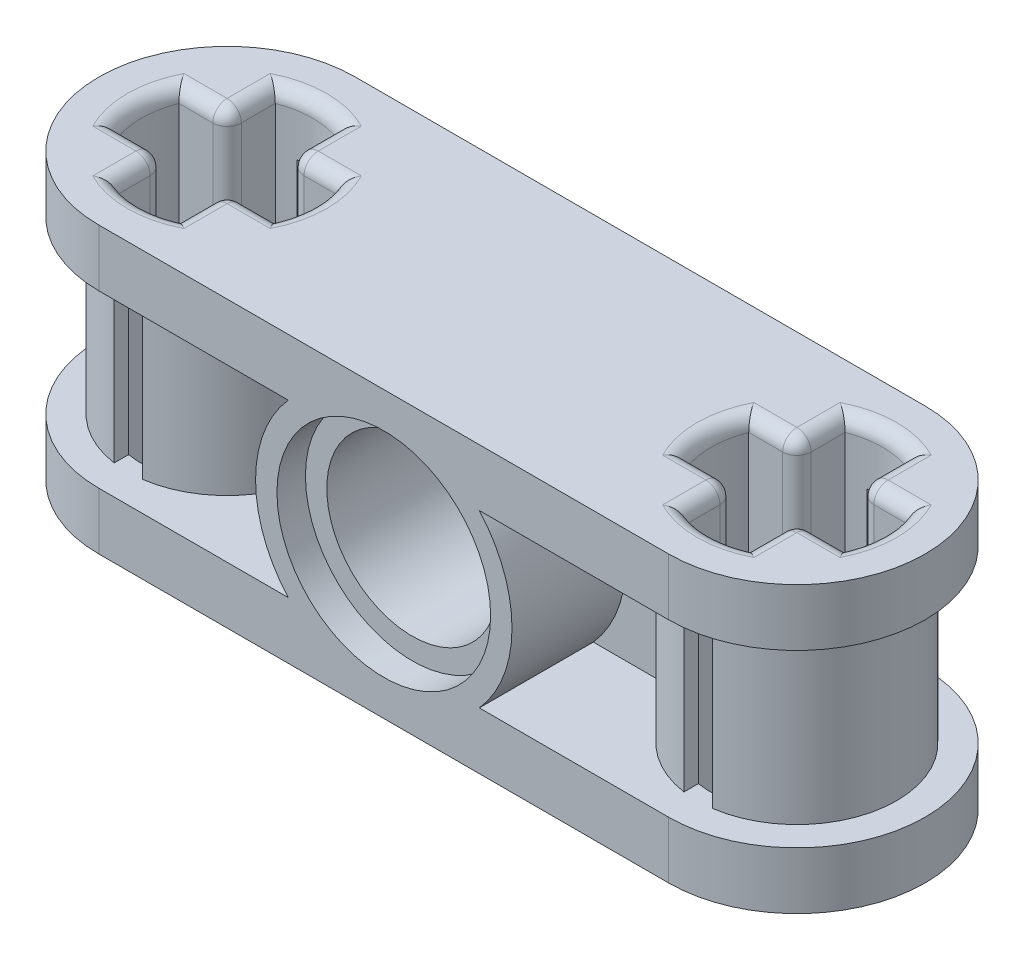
SolidWorks part; units mm, degrees
other "<3>-<Cut-Extrude3>"
other "<3>-<Cut-Extrude3>"
ref_plane "Front Plane" through (0, 0, 0) normal (0, 0, 1) x (1, 0, 0)
ref_plane "Top Plane" through (0, 0, 0) normal (0, 1, 0) x (1, 0, 0)
ref_plane "Right Plane" through (0, 0, 0) normal (1, 0, 0) x (0, 0, -1)
inserted part "3"
move or copy body "Body-Move/Copy2"
inserted part "34"
move or copy body "Body-Move/Copy8" placed by mates yes
other "Distance2" parameters "D1"=16
sketch "Sketch1" plane through (0, 11.0018, 0) normal (0, 1, 0) x (1, 0, 0)
  line L0 (-36.4578, -10.8814) -> (-20.4578, -10.8814)
  line L1 (-36.4578, -18.0814) -> (-20.4578, -18.0814)
  line L2 (-35.5338, -11.002) -> (-35.5338, -11.8382)
  line L3 (-35.5338, -17.1245) -> (-35.5338, -17.9608)
  line L5 (-21.3818, -17.1245) -> (-21.3818, -17.9608)
  line L6 (-21.3818, -11.002) -> (-21.3818, -11.8382)
  circle A0 centre (-36.4578, -14.4814) radius 3.6 construction
  arc A2 (-36.4578, -10.8814) -> (-35.5338, -11.002) centre (-36.4578, -14.4814) cw
  arc A4 (-35.5338, -11.8382) -> (-35.5338, -17.1245) centre (-36.4578, -14.4814) cw
  arc A6 (-35.5338, -17.9608) -> (-36.4578, -18.0814) centre (-36.4578, -14.4814) cw
  arc A7 (-21.3818, -17.9608) -> (-20.4578, -18.0814) centre (-20.4578, -14.4814) ccw
  arc A8 (-21.3818, -11.8382) -> (-21.3818, -17.1245) centre (-20.4578, -14.4814) ccw
  arc A9 (-20.4578, -10.8814) -> (-21.3818, -11.002) centre (-20.4578, -14.4814) ccw
extrude "Boss-Extrude1" add sketch "Sketch1" against normal up to surface (8 mm away)
ref_plane "Plane1" through (0, 7.0018, 0) normal (0, 1, 0) x (1, 0, 0)
sketch "Sketch3" plane through (0, 0, 18.0814) normal (0, 0, 1) x (1, 0, 0)
  line L0 (3.96, 7.0018) -> (-3.96, 7.0018) construction
  line L1 (-36.4578, 4.6018) -> (-36.4578, 9.4018) construction
  circle A0 centre (-28.4578, 7.0018) radius 2.4
  dimension "D1" = 8
extrude "Cut-Extrude3" cut sketch "Sketch3" against normal through all
sketch "Sketch4" plane through (0, 0, 18.0814) normal (0, 0, 1) x (1, 0, 0)
  line L0 (-33.3578, 9.4018) -> (-31.1411, 9.4018)
  line L1 (-23.5578, 9.4018) -> (-25.7745, 9.4018)
  line L2 (-23.5578, 4.6018) -> (-25.7745, 4.6018)
  line L4 (-33.3578, 4.6018) -> (-31.1411, 4.6018)
  line L5 (-33.3578, 9.4018) -> (-33.3578, 4.6018)
  line L7 (-23.5578, 9.4018) -> (-23.5578, 4.6018)
  arc A2 (-25.7745, 4.6018) -> (-25.7745, 9.4018) centre (-28.4578, 7.0018) ccw
  arc A3 (-31.1411, 9.4018) -> (-31.1411, 4.6018) centre (-28.4578, 7.0018) ccw
extrude "Cut-Extrude4" cut sketch "Sketch4" against normal blind 3.2
ref_plane "Plane2" through (0, 0, 14.4814) normal (0, 0, -1) x (-1, 0, 0)
mirror "Mirror1" about plane through (0, 0, 14.4814) normal (0, 0, -1) of "Cut-Extrude4"
sketch "Sketch5" plane through (0, 7.0018, 0) normal (0, 1, 0) x (1, 0, 0)
  line L0 (-36.4578, -11.6814) -> (-36.4578, -10.8814)
  line L1 (-36.4578, -10.8814) -> (-32.4578, -10.8814)
  line L2 (-20.4578, -10.8814) -> (-36.4578, -10.8814) construction
  line L3 (-32.4578, -10.8814) -> (-32.4578, -14.0814)
  line L4 (-32.4578, -14.0814) -> (-33.6865, -14.0814)
  line L5 (-36.4578, -18.0814) -> (-36.4578, -17.2814)
  line L7 (-36.4578, -18.0814) -> (-32.4578, -18.0814)
  line L8 (-36.4578, -18.0814) -> (-20.4578, -18.0814) construction
  line L9 (-32.4578, -18.0814) -> (-32.4578, -14.8814)
  line L10 (-32.4578, -14.8814) -> (-33.6865, -14.8814)
  line L11 (-28.4578, -10.8814) -> (-28.4578, -18.0814) construction
  line L12 (-24.4578, -14.8814) -> (-23.2291, -14.8814)
  line L13 (-24.4578, -18.0814) -> (-24.4578, -14.8814)
  line L14 (-20.4578, -18.0814) -> (-24.4578, -18.0814)
  line L15 (-20.4578, -18.0814) -> (-20.4578, -17.2814)
  line L16 (-24.4578, -14.0814) -> (-23.2291, -14.0814)
  line L17 (-24.4578, -10.8814) -> (-24.4578, -14.0814)
  line L18 (-20.4578, -10.8814) -> (-24.4578, -10.8814)
  line L19 (-20.4578, -11.6814) -> (-20.4578, -10.8814)
  arc A0 (-36.4578, -17.2814) -> (-33.6865, -14.8814) centre (-36.4578, -14.4814) ccw
  arc A1 (-33.6865, -14.0814) -> (-36.4578, -11.6814) centre (-36.4578, -14.4814) ccw
  arc A2 (-23.2291, -14.0814) -> (-20.4578, -11.6814) centre (-20.4578, -14.4814) cw
  arc A3 (-20.4578, -17.2814) -> (-23.2291, -14.8814) centre (-20.4578, -14.4814) cw
  dimension "D4" = 5.6
  dimension "D1" = 4
  dimension "D2" = 3.2
  dimension "D3" = 3.2
extrude "Cut-Extrude5" cut sketch "Sketch5" against normal up to surface and the other way up to surface
sketch "Sketch6" plane through (0, 0, 18.0814) normal (0, 0, 1) x (1, 0, 0)
  circle A0 centre (-28.4578, 7.0018) radius 3
extrude "Cut-Extrude6" cut sketch "Sketch6" against normal blind 0.8
mirror "Mirror2" about plane through (0, 0, 14.4814) normal (0, 0, -1) of "Cut-Extrude6"
